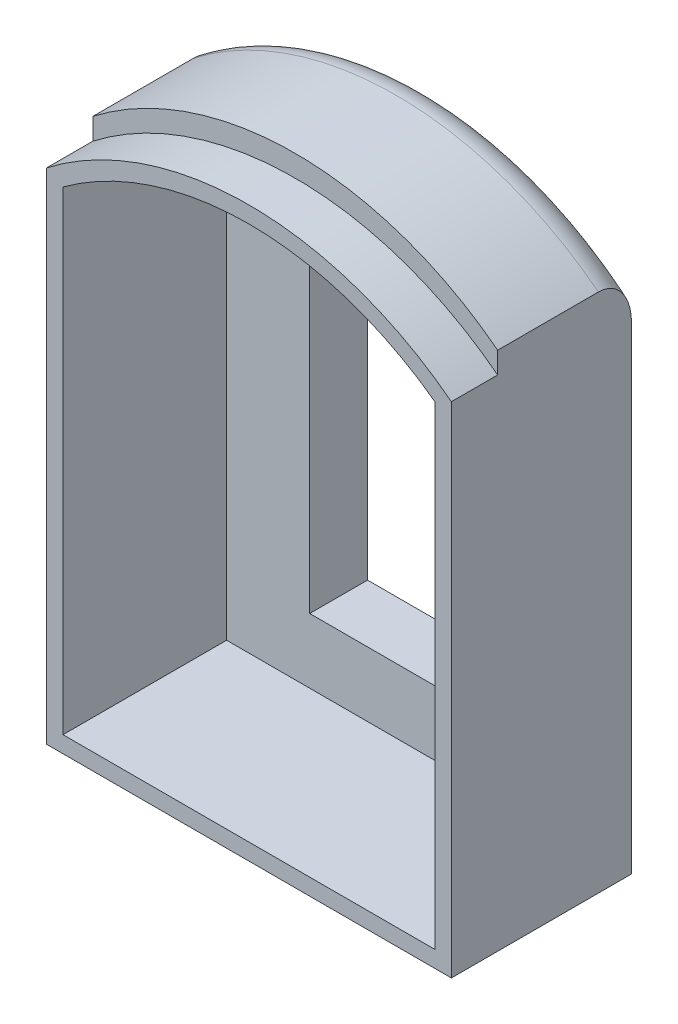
SolidWorks part; units mm, degrees
ref_plane "Front Plane" through (0, 0, 0) normal (0, 0, 1) x (1, 0, 0)
ref_plane "Top Plane" through (0, 0, 0) normal (0, 1, 0) x (1, 0, 0)
ref_plane "Right Plane" through (0, 0, 0) normal (1, 0, 0) x (0, 0, -1)
sketch "Sketch1" plane through (0, 0, 0) normal (0, 0, 1) x (1, 0, 0)
  line L0 (-12.25, 30.2) -> (-12.25, 0)
  line L1 (-12.25, 0) -> (12.25, 0)
  line L2 (12.25, 0) -> (12.25, 30.2)
  arc A0 (-12.25, 30.2) -> (12.25, 30.2) centre (0, 14.3906) cw
  dimension "D3" = 20
  dimension "D1" = 24.5
  dimension "D2" = 30.2
extrude "Boss-Extrude1" add sketch "Sketch1" along normal blind 10
shell "Shell1" thickness 1
sketch "Sketch6" plane through (0, 0, 0) normal (0, 0, -1) x (-1, 0, 0)
  line L0 (-12.25, 30.2) -> (-12.25, 31.5)
  line L1 (12.25, 30.2) -> (12.25, 31.5)
  arc A0 (-12.25, 30.2) -> (12.25, 30.2) centre (0, 14.3906) cw
  arc A1 (-12.25, 31.5) -> (12.25, 31.5) centre (0, 15.6906) cw
  dimension "D1" = 20
  dimension "D2" = 20
  dimension "D3" = 1.3
  dimension "D4" = 1.3
extrude "Boss-Extrude6" add sketch "Sketch6" against normal blind 7.2
sketch "Sketch7" plane through (0, 0, 0) normal (0, 0, -1) x (-1, 0, 0)
  line L3 (12.25, 0) -> (12.25, 31.5)
  line L4 (-12.25, 31.5) -> (-12.25, 0)
  line L5 (-12.25, 0) -> (12.25, 0)
  line L6 (12.25, 0) -> (12.25, 31.5)
  line L7 (-12.25, 31.5) -> (-12.25, 0)
  line L8 (-12.25, 0) -> (12.25, 0)
  arc A1 (12.25, 31.5) -> (-12.25, 31.5) centre (0, 15.6906) ccw
  arc A4 (12.25, 31.5) -> (-12.25, 31.5) centre (0, 15.6906) ccw
  dimension "D1" = 0
extrude "Boss-Extrude7" add sketch "Sketch7" along normal blind 0.9
sketch "Sketch8" plane through (0, 0, 1) normal (0, 0, 1) x (1, 0, 0)
  line L3 (-11.25, 29.7019) -> (-11.25, 1)
  line L4 (-11.25, 1) -> (11.25, 1)
  line L5 (11.25, 1) -> (11.25, 29.7019)
  line L6 (-11.25, 29.7019) -> (-11.25, 1)
  line L7 (-11.25, 1) -> (11.25, 1)
  line L8 (11.25, 1) -> (11.25, 29.7019)
  arc A1 (11.25, 29.7019) -> (-11.25, 29.7019) centre (0, 14.3906) ccw
  arc A2 (11.25, 29.7019) -> (-11.25, 29.7019) centre (0, 14.3906) ccw
  dimension "D1" = 0
extrude "Cut-Extrude1" cut sketch "Sketch8" against normal blind 0.9
fillet "Fillet1" radius 2 1 edges at (0, 35.6906, -0.9)
sketch "Sketch12" plane through (0, 0, -0.9) normal (0, 0, -1) x (-1, 0, 0)
  line L0 (-12.25, 28.8791) -> (-12.25, 0) construction
  line L1 (8.223, 2.9146) -> (-8.223, 2.9146)
  line L2 (8.223, 2.9146) -> (8.223, 25.9646)
  line L3 (8.223, 25.9646) -> (-8.223, 25.9646)
  line L4 (-8.223, 2.9146) -> (-8.223, 25.9646)
  line L5 (8.223, 2.9146) -> (-8.223, 25.9646) construction
  line L6 (8.223, 25.9646) -> (-8.223, 2.9146) construction
  point P0 (0, 14.4396)
  point P7 (-12.25, 14.4396)
  dimension "D1" = 16.446
  dimension "D2" = 23.05
extrude "Boss-Extrude9" add sketch "Sketch12" along normal blind 2.5
sketch "Sketch14" plane through (0, 0, -3.4) normal (0, 0, -1) x (-1, 0, 0)
  line L0 (-8.223, 25.9646) -> (-8.223, 2.9146) construction
  line L1 (6.223, 4.9146) -> (-6.223, 4.9146)
  line L2 (6.223, 4.9146) -> (6.223, 23.9646)
  line L3 (6.223, 23.9646) -> (-6.223, 23.9646)
  line L4 (-6.223, 4.9146) -> (-6.223, 23.9646)
  line L5 (6.223, 4.9146) -> (-6.223, 23.9646) construction
  line L6 (6.223, 23.9646) -> (-6.223, 4.9146) construction
  line L7 (-8.223, 25.9646) -> (-8.223, 2.9146) construction
  line L8 (8.223, 25.9646) -> (-8.223, 25.9646) construction
  point P0 (0, 14.4396)
  point P7 (-8.223, 14.4396)
  dimension "D1" = 2
  dimension "D2" = 2
extrude "Cut-Extrude5" cut sketch "Sketch14" against normal up to surface (3.5 mm away)
fillet "Fillet2" radius 1 8 edges at (8.223, 14.4396, -0.9) (0, 25.9646, -0.9) (-8.223, 14.4396, -0.9) (0, 2.9146, -0.9) (0, 25.9646, -3.4) (-8.223, 14.4396, -3.4) (0, 2.9146, -3.4) (8.223, 14.4396, -3.4)
